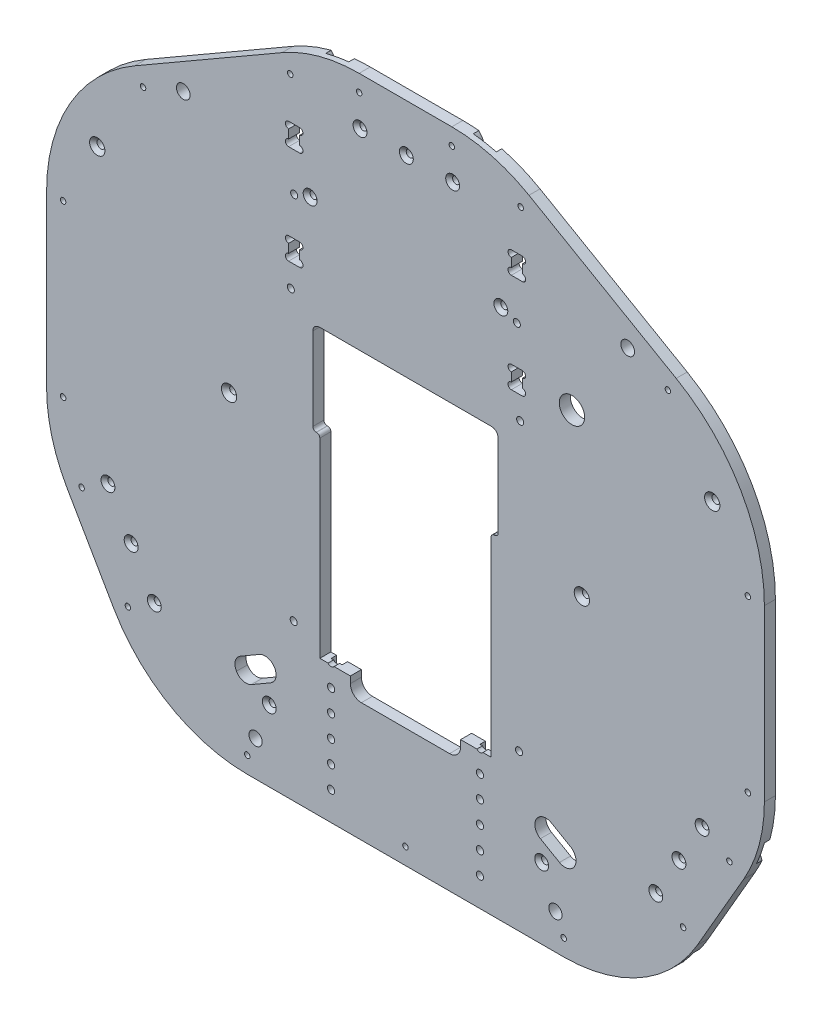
SolidWorks part; units mm, degrees
ref_plane "Front Plane" through (0, 0, 0) normal (0, 0, 1) x (1, 0, 0)
ref_plane "Top Plane" through (0, 0, 0) normal (0, 1, 0) x (1, 0, 0)
ref_plane "Right Plane" through (0, 0, 0) normal (1, 0, 0) x (0, 0, -1)
imported_body "Top_plate_v2.1_new.par<1>"
sketch "Sketch1" plane through (0, 0, 5) normal (0, 0, 1) x (1, 0, 0)
  line L0 (146.906, -60.556) -> (125.8951, -96.948) construction
  line L1 (134.5392, -53.416) -> (124.0337, -71.612) construction
  line L2 (124.0337, -71.612) -> (113.5282, -89.808) construction
  line L3 (134.5392, -53.416) -> (146.906, -60.556) construction
  line L4 (113.5282, -89.808) -> (125.8951, -96.948) construction
  line L6 (-134.9277, -53.1893) -> (-113.9157, -89.583) construction
  line L9 (-147.0993, -60.2166) -> (-125.8924, -96.948) construction
  line L10 (-20.6206, 157.5) -> (21.4006, 157.5) construction
  line L11 (-20.6206, 157.5) -> (-20.6206, 143.4454) construction
  line L12 (-20.6206, 143.4454) -> (21.4006, 143.4454) construction
  line L13 (21.4006, 157.5) -> (21.4006, 143.4454) construction
  line L14 (-147.0993, -60.2166) -> (-134.9277, -53.1893) construction
  line L15 (-125.8924, -96.948) -> (-113.7207, -89.9207) construction
  line L16 (-113.7207, -89.9207) -> (-113.9157, -89.583)
  circle A2 centre (134.5392, -53.416) radius 1.6
  circle A3 centre (113.5282, -89.808) radius 1.6
  circle A4 centre (124.0337, -71.612) radius 1.6
  circle A5 centre (-134.9277, -53.1893) radius 1.6
  circle A6 centre (-124.4217, -71.3861) radius 1.6
  circle A8 centre (21.4006, 143.4454) radius 1.6
  circle A9 centre (0.39, 143.4454) radius 1.6
  circle A10 centre (-20.6206, 143.4454) radius 1.6
  circle A11 centre (-146.9043, -60.5543) radius 1.25 construction
  circle A12 centre (-146.9043, -60.5543) radius 1.25 construction
  circle A13 centre (-125.8924, -96.948) radius 1.25 construction
  circle A14 centre (-125.8924, -96.948) radius 1.25 construction
  circle A15 centre (-113.9157, -89.583) radius 1.6
  circle A16 centre (21.0106, 157.5) radius 1.25 construction
  circle A17 centre (21.0106, 157.5) radius 1.25 construction
  circle A18 centre (-21.0106, 157.5) radius 1.25 construction
  circle A19 centre (-21.0106, 157.5) radius 1.25 construction
  point P23 (-124.4217, -71.3861)
hole_wizard "CSK for M3 Countersunk Flat Head Screw1" positions "Sketch2" profile "Sketch3" countersink size "M3" standard "ISO"
sketch "Sketch2" plane through (0, 0, 5) normal (0, 0, 1) x (1, 0, 0)
  point P0 (113.5282, -89.808)
  point P3 (124.0337, -71.612)
  point P6 (134.5392, -53.416)
  point P9 (-20.6206, 143.4454)
  point P12 (0.39, 143.4454)
  point P15 (21.4006, 143.4454)
  point P18 (-113.9157, -89.583)
  point P21 (-124.4217, -71.3861)
  point P24 (-134.9277, -53.1893)
sketch "Sketch3" plane through (113.5282, -89.808, 5) normal (1, 0, 0) x (0, -1, 0)
  line L0 (0, 0) -> (0, 5)
  line L1 (0, 5) -> (1.6, 5)
  line L2 (1.6, 5) -> (1.6, 1.55)
  line L3 (1.6, 1.55) -> (3.15, 0)
  line L5 (3.15, 0) -> (0, 0)
  line L6 (-1.6, 1.55) -> (-3.15, 0) construction
  line L11 (0, -6.35) -> (0, 107.95) construction
  dimension "Thru Hole Dia." = 3.2
  dimension "Thru Hole Depth" = 5
  dimension "Near C'Sink Dia." = 6.3
  dimension "Near C'Sink Angle" = 90
equation "\"D1@Sketch1\"=49-34.72mm"
